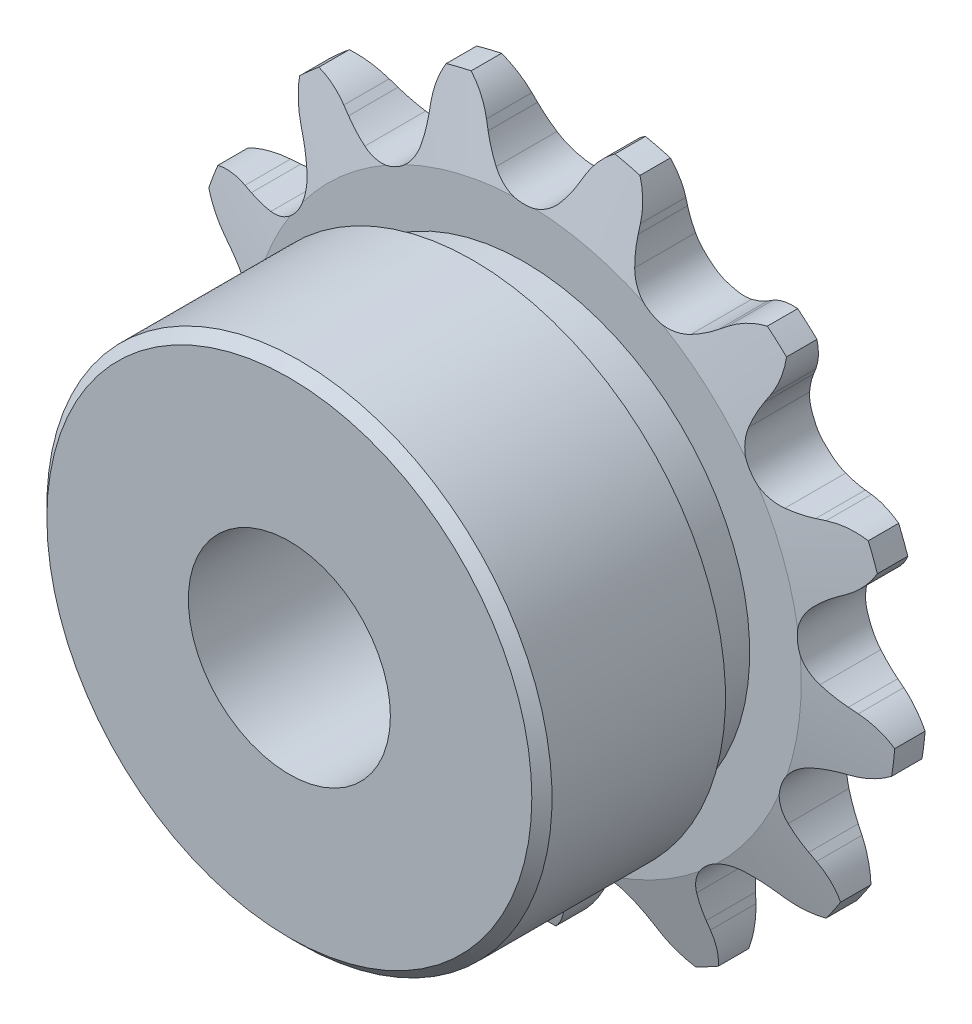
SolidWorks part; units mm, degrees
ref_plane "Front Plane" through (0, 0, 0) normal (0, 0, 1) x (1, 0, 0)
ref_plane "Top Plane" through (0, 0, 0) normal (0, 1, 0) x (1, 0, 0)
ref_plane "Right Plane" through (0, 0, 0) normal (1, 0, 0) x (0, 0, -1)
sketch "Sketch0" plane through (0, 0, 0) normal (0, 0, 1) x (1, 0, 0)
  line L0 (4.7625, -19.3222) -> (0, 0) construction
  line L1 (0, 0) -> (13.1965, -14.8957) construction
  line L2 (0, 0) -> (-4.7625, -19.3222) construction
  line L3 (4.7625, -19.3222) -> (13.1965, -14.8957) construction
  line L4 (4.7625, -19.3222) -> (-4.7625, -19.3222) construction
  line L5 (7.7945, -18.7347) -> (7.458, -18.3304)
  line L6 (4.7625, -19.3222) -> (0, -20.4961) construction
  line L7 (1.8048, -20.2111) -> (1.9148, -19.6967)
  line L8 (0, -19.3222) -> (0, -22.1797) construction
  line L9 (6.305, -17.2406) -> (2.3429, -22.5875) construction
  line L10 (0, 0) -> (0, -19.3222) construction
  line L11 (7.458, -18.3304) -> (2.3429, -22.5875) construction
  line L12 (0, -22.1797) -> (0, -22.8617) construction
  line L13 (11.0599, -16.0171) -> (7.7945, -18.7347) construction
  circle A0 centre (0, 0) radius 22.1797 construction
  circle A1 centre (0, 0) radius 19.9005 construction
  arc A2 (-2.8623, -23.5395) -> (13.4738, -19.513) centre (0, 0) ccw
  circle A3 centre (0, 0) radius 22.8617 construction
  circle A4 centre (4.7625, -19.3222) radius 2.54 construction
  arc A7 (6.305, -17.2406) -> (2.4293, -18.1959) centre (4.7625, -19.3222) ccw
  circle A8 centre (4.7625, -19.3222) radius 2.5908 construction
  arc A9 (7.7945, -18.7347) -> (13.4738, -19.513) centre (11.0599, -16.0171) ccw
  arc A10 (7.458, -18.3304) -> (6.305, -17.2406) centre (2.3429, -22.5875) ccw
  arc A11 (1.8048, -20.2111) -> (-2.8623, -23.5395) centre (-2.3495, -19.3222) cw
  arc A12 (1.9148, -19.6967) -> (2.4293, -18.1959) centre (8.4223, -21.089) cw
  dimension "D1" = 2.5908
  dimension "Dr" = 5.08
  dimension "Ds" = 5.1816
  dimension "R" = 2.5908
  dimension "Pitch" = 9.525
  dimension "A" = 39.615
  dimension "360/N" = 27.692
  dimension "B" = 13.692
  dimension "ab" = 7.112
  dimension "J" = 2.8575
  dimension "ac" = 4.064
sketch "Sketch1" plane through (0, 0, 0) normal (1, 0, 0) x (0, 0, -1)
  line L0 (2.1463, 0) -> (-2.1463, 0)
  line L1 (-2.1463, 0) -> (-2.1463, 17.4172)
  line L2 (-2.1463, 17.4172) -> (-0.9557, 22.1797)
  line L3 (-0.9557, 22.1797) -> (0.9557, 22.1797)
  line L4 (0.9557, 22.1797) -> (2.1463, 17.4172)
  line L5 (2.1463, 17.4172) -> (2.1463, 0)
  line L7 (0, 22.1797) -> (0, 0) construction
  line L8 (-2.1463, 17.4172) -> (2.1463, 17.4172) construction
  line L9 (0, 22.1797) -> (0, -22.1797) construction
  line L10 (-2.1463, 17.4172) -> (-2.1463, 22.1797) construction
  line L11 (-2.1463, 22.1797) -> (-0.9557, 22.1797) construction
  line L12 (0.9557, 22.1797) -> (2.1463, 22.1797) construction
  line L13 (2.1463, 22.1797) -> (2.1463, 17.4172) construction
  line L14 (0, 0) -> (-6.4008, 0) construction
  line L22 (2.1463, 0) -> (-16.9037, 0) construction
  line L24 (-2.1463, 0) -> (-2.1463, 14.1787) construction
  dimension "t" = 4.2926
  dimension "g" = 1.1906
  dimension "h" = 4.7625
  dimension "K" = 6.4008
  dimension "MHD" = 28.3574
  dimension "Width" = 19.05
revolve "Revolve1" add sketch "Sketch1" angle 360 mid plane about L0
extrude "Cut-Extrude1" cut sketch "Sketch0" against normal through all and the other way through all
pattern_circular "CirPattern1" count 13 over 360 about axis through (0, 0, 0) along (0, 0, 1) of "Cut-Extrude1"
sketch "Sketch2" plane through (0, 0, 0) normal (0, 0, 1) x (1, 0, 0)
  circle A0 centre (0, 0) radius 6.35 construction
  circle A1 centre (0, 0) radius 15.875
  circle A2 centre (0, 0) radius 22.225 construction
  dimension "Bore" = 12.7
  dimension "Hub Dia." = 31.75
  dimension "OD" = 44.45
extrude "Boss-Extrude1" add sketch "Sketch2" along normal up to vertex (16.9037 mm away) from surface at 2.1463
sketch "Sketch3" plane through (0, 0, 0) normal (0, 0, 1) x (1, 0, 0)
  circle A0 centre (0, 0) radius 6.35 construction
  circle A1 centre (0, 0) radius 6.35
extrude "Cut-Extrude2" cut sketch "Sketch3" along normal through all and the other way through all
sketch "Sketch4" plane through (0, 0, 0) normal (1, 0, 0) x (0, 0, -1)
  line L0 (-16.9037, 15.875) -> (-16.9037, 15.24)
  line L1 (-2.1463, 22.1797) -> (-5.3658, 22.1797)
  line L2 (-2.1463, 22.1797) -> (-2.1463, 14.1787)
  line L3 (-2.1463, 14.1787) -> (-5.3658, 14.1787)
  line L4 (-5.3658, 22.1797) -> (-5.3658, 14.1787)
  line L9 (-16.9037, 15.24) -> (-16.2687, 15.875)
  line L10 (-16.2687, 15.875) -> (-16.9037, 15.875)
  dimension "C" = 0.635
  dimension "D3" = 3.2195
revolve "Cut-Revolve1" cut sketch "Sketch4" angle 360 mid plane about L22
equation "\"360/N@Sketch0\" = 360/\"Teeth@CirPattern1\""
equation "\"Ds@Sketch0\" = 1.005 * \"Dr@Sketch0\" + 0.003"
equation "\"R@Sketch0\" = 1/2 * \"Ds@Sketch0\""
equation "\"A@Sketch0\" = 35 +  ( 60 / \"Teeth@CirPattern1\" ) "
equation "\"B@Sketch0\" = 18 -  ( 56 / \"Teeth@CirPattern1\" )"
equation "\"ac@Sketch0\" = 0.8 * \"Dr@Sketch0\""
equation "\"ab@Sketch0\" = 1.4 * \"Dr@Sketch0\""
equation "\"J@Sketch0\" = 0.3 * \"Pitch@Sketch0\""
equation "\"h@Sketch1\" = \"Pitch@Sketch0\" / 2"
equation "\"g@Sketch1\" = \"h@Sketch1\" / 4"
equation "\"MHD@Sketch1\" = \"Pitch@Sketch0\" * ( cotan ( 180 / \"Teeth@CirPattern1\" ) - 1 ) - 0.030"
equation "\"D3@Sketch4\" = \"t@Sketch1\" * 3 / 4"
